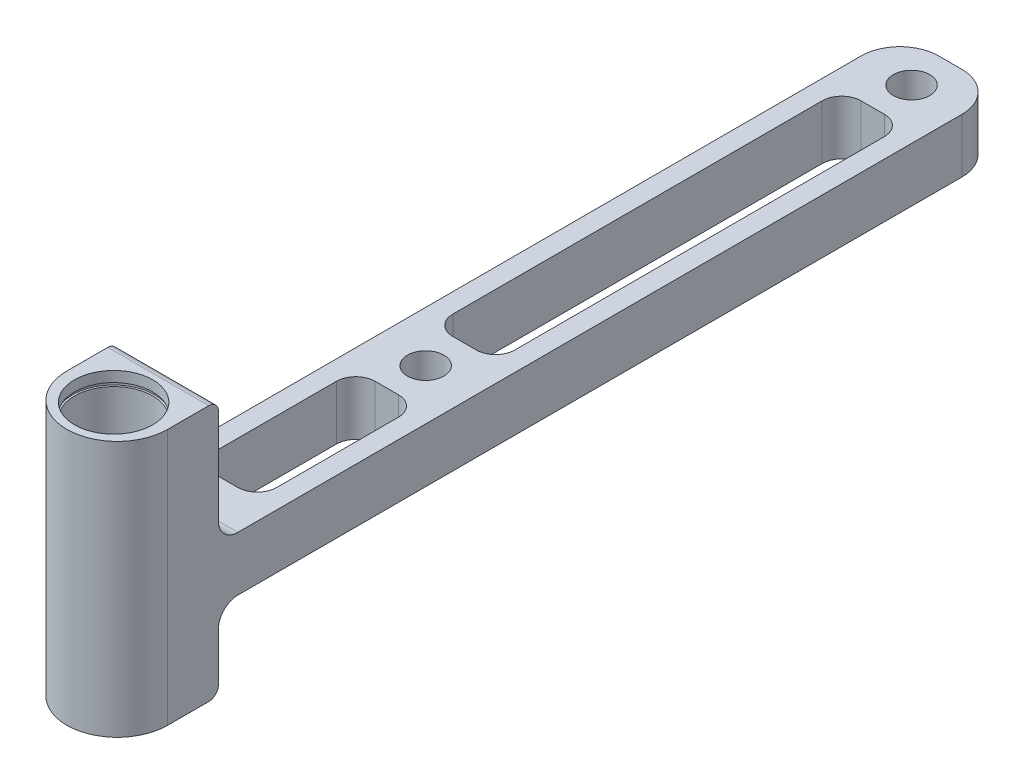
SolidWorks part; units mm, degrees
ref_plane "Front Plane" through (0, 0, 0) normal (0, 0, 1) x (1, 0, 0)
ref_plane "Top Plane" through (0, 0, 0) normal (0, 1, 0) x (1, 0, 0)
ref_plane "Right Plane" through (0, 0, 0) normal (1, 0, 0) x (0, 0, -1)
sketch "Sketch1" plane through (0, 0, 0) normal (0, 1, 0) x (1, 0, 0)
  line L0 (0, 8.89) -> (0, 0) construction
  line L2 (-8.255, 0.5969) -> (-8.255, 8.89)
  line L3 (-8.255, 8.89) -> (8.255, 8.89)
  line L4 (8.255, 0.5969) -> (8.255, 8.89)
  circle A1 centre (0, 0) radius 6.3881
  arc A4 (-8.255, 0.5969) -> (8.255, 0.5969) centre (0, 0.5969) ccw
  dimension "D1" = 8.89
  dimension "D2" = 12.7762
  dimension "D3" = 1.27
  dimension "D4" = 16.51
extrude "Boss-Extrude1" add sketch "Sketch1" along normal mid plane 41.91
sketch "Sketch2" plane through (8.255, 0, 0) normal (1, 0, 0) x (0, 0, -1)
  line L1 (12.065, 0.635) -> (142.24, 0.635)
  line L2 (142.24, 0.635) -> (142.24, -8.255)
  line L3 (142.24, -8.255) -> (12.065, -8.255)
  line L6 (0.5969, -20.955) -> (8.89, -20.955) construction
  line L7 (8.89, 3.81) -> (8.89, -11.43)
  line L8 (8.89, 20.955) -> (8.89, -20.955) construction
  arc A0 (12.065, 0.635) -> (8.89, 3.81) centre (12.065, 3.81) cw
  arc A1 (12.065, -8.255) -> (8.89, -11.43) centre (12.065, -11.43) ccw
  dimension "D3" = 3.175
  dimension "D1" = 12.7
  dimension "D2" = 8.89
extrude "Boss-Extrude2" add sketch "Sketch2" against normal up to surface (16.51 mm away)
sketch "Sketch3" plane through (0, -20.955, 0) normal (0, -1, 0) x (1, 0, 0)
  circle A0 centre (0, 0) radius 6.3881
  circle A1 centre (0, 0) radius 6.3881 construction
  circle A2 centre (0, 0) radius 5.7531
  dimension "D1" = 0.635
extrude "Boss-Extrude3" add sketch "Sketch3" against normal blind 1.27
hole_wizard "15/64 (0.23438) Diameter Hole1" positions "Sketch5" profile "Sketch6" hole size "15/64" standard "ANSI Inch"
sketch "Sketch5" plane through (0, 0.635, 0) normal (0, 1, 0) x (1, 0, 0)
  circle A0 centre (34.925, 90.7533) radius 52.8955 construction
  point P0 (0, 130.4796)
  point P2 (0, 51.027)
  point P24 (0, 0)
  point P25 (0, 0)
sketch "Sketch6" plane through (0, 0.635, -130.4796) normal (1, 0, 0) x (0, 0, 1)
  line L0 (0, 0) -> (0, 21.59)
  line L1 (0, 21.59) -> (2.9766, 21.59)
  line L2 (2.9766, 21.59) -> (2.9766, 0)
  line L5 (2.9766, 0) -> (0, 0)
  line L11 (0, -6.35) -> (0, 107.95) construction
  dimension "Thru Hole Dia." = 5.9533
  dimension "Thru Hole Depth" = 21.59
sketch "Sketch4" plane through (0, 20.955, 0) normal (0, 1, 0) x (1, 0, 0)
  line L2 (8.255, 142.24) -> (8.255, 12.065) construction
  line L6 (0, 123.19) -> (0, 25.4) construction
  line L7 (5.08, 120.9546) -> (5.08, 60.552)
  line L8 (-5.08, 120.9546) -> (-5.08, 60.552)
  line L10 (-1.905, 18.415) -> (1.905, 18.415)
  line L11 (-1.905, 57.377) -> (1.905, 57.377)
  line L12 (-1.905, 44.677) -> (1.905, 44.677)
  line L13 (0, 51.027) -> (17.2023, 51.027) construction
  line L14 (-5.08, 41.502) -> (-5.08, 21.59)
  line L15 (5.08, 41.502) -> (5.08, 21.59)
  line L16 (-1.905, 124.1296) -> (1.905, 124.1296)
  line L18 (-8.255, 12.065) -> (8.255, 12.065) construction
  line L19 (-8.255, 142.24) -> (8.255, 142.24)
  line L20 (-8.255, 142.24) -> (-8.255, 136.8296)
  line L21 (-8.255, 136.8296) -> (8.255, 136.8296)
  line L22 (8.255, 142.24) -> (8.255, 136.8296)
  arc A2 (-1.905, 57.377) -> (-5.08, 60.552) centre (-1.905, 60.552) cw
  arc A3 (1.905, 57.377) -> (5.08, 60.552) centre (1.905, 60.552) ccw
  arc A4 (1.905, 44.677) -> (5.08, 41.502) centre (1.905, 41.502) cw
  arc A5 (-1.905, 44.677) -> (-5.08, 41.502) centre (-1.905, 41.502) ccw
  arc A6 (5.08, 120.9546) -> (1.905, 124.1296) centre (1.905, 120.9546) ccw
  arc A7 (-5.08, 120.9546) -> (-1.905, 124.1296) centre (-1.905, 120.9546) cw
  arc A8 (5.08, 21.59) -> (1.905, 18.415) centre (1.905, 21.59) cw
  arc A9 (-5.08, 21.59) -> (-1.905, 18.415) centre (-1.905, 21.59) ccw
  circle A10 centre (0, 130.4796) radius 2.9766 construction
  point P27 (5.08, 44.677)
  point P30 (-5.08, 44.677)
  point P31 (5.08, 124.1296)
  dimension "D6" = 3.175
  dimension "D3" = 6.35
  dimension "D2" = 6.35
  dimension "D1" = 3.175
  dimension "D4" = 12.7
  dimension "D5" = 12.7
extrude "Cut-Extrude1" cut sketch "Sketch4" against normal through all
sketch "Sketch7" plane through (0, 0, 0) normal (0, 0, 1) x (1, 0, 0)
  line L0 (0, 0) -> (0, 20.9678) construction
  line L1 (-6.7056, 19.2278) -> (-4.1656, 19.2278)
  line L2 (-6.7056, 19.2278) -> (-6.7056, 18.669)
  line L3 (-6.7056, 18.669) -> (-4.1656, 18.669)
  line L4 (-4.1656, 19.2278) -> (-4.1656, 18.669)
  line L6 (5.7531, -19.685) -> (-5.7531, -19.685) construction
  dimension "D1" = 13.4112
  dimension "D2" = 0.5588
  dimension "D3" = 2.54
  dimension "D4" = 38.354
revolve "Cut-Revolve1" cut sketch "Sketch7" angle 360 about L0
fillet "Fillet1" radius 6.35 2 edges at (8.255, -3.81, -136.8296) (-8.255, -3.81, -136.8296)
fillet "Fillet2" radius 1.5875 2 edges at (0, -20.955, -8.89) (0, 20.955, -8.89)
